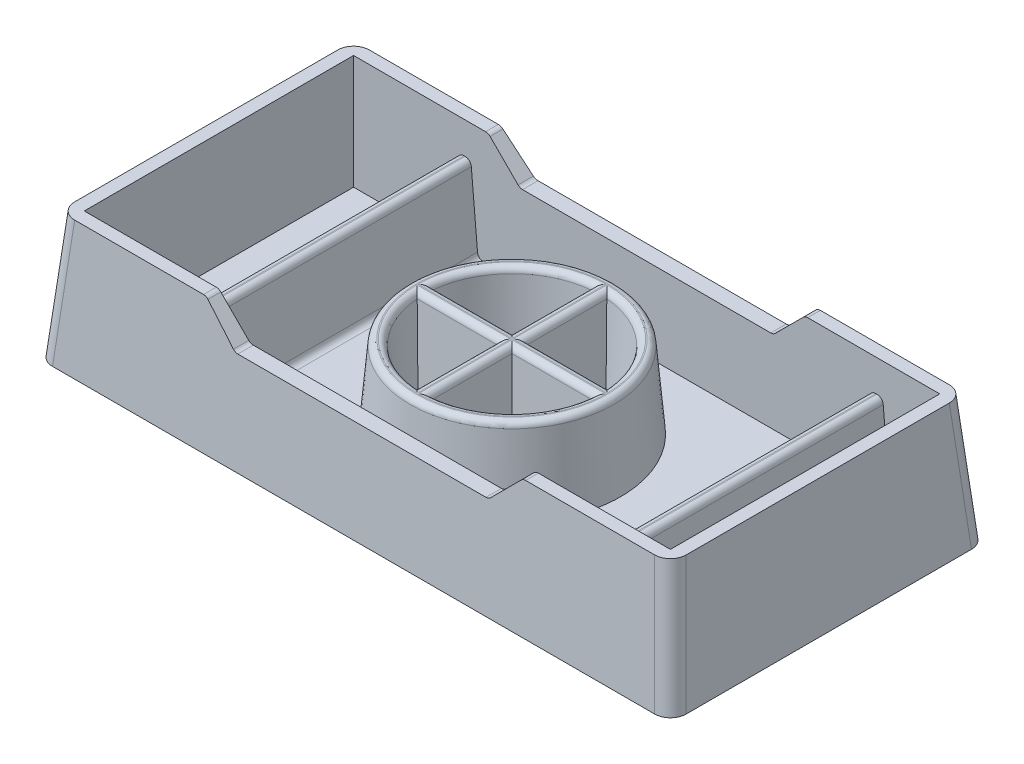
SolidWorks part; units mm, degrees
ref_plane "Ebene vorne" through (0, 0, 0) normal (0, 0, 1) x (1, 0, 0)
ref_plane "Ebene oben" through (0, 0, 0) normal (0, 1, 0) x (1, 0, 0)
ref_plane "Ebene rechts" through (0, 0, 0) normal (1, 0, 0) x (0, 0, -1)
sketch "Skizze1" plane through (0, 0, 0) normal (0, 1, 0) x (1, 0, 0)
  line L1 (-100, 50) -> (100, 50)
  line L2 (-100, 50) -> (-100, -50)
  line L3 (-100, -50) -> (100, -50)
  line L4 (100, 50) -> (100, -50)
  line L5 (-100, 50) -> (100, -50) construction
  line L6 (-100, -50) -> (100, 50) construction
  point P0 (0, 0)
  dimension "D1" = 200
  dimension "D2" = 100
extrude "Aufsatz-Linear austragen1" add sketch "Skizze1" along normal blind 40 draft 5
sketch "Skizze2" plane through (0, 0, 0) normal (0, 0, 1) x (1, 0, 0)
  line L0 (0, 0) -> (0, 84.0076) construction
  line L1 (-50, 40) -> (50, 40)
  line L2 (50, 40) -> (40, 30)
  line L3 (40, 30) -> (-40, 30)
  line L4 (-40, 30) -> (-50, 40)
  line L5 (-96.5005, 40) -> (96.5005, 40) construction
  point P5 (0, 0)
  point P8 (0, 0)
  dimension "D1" = 100
  dimension "D2" = 45
  dimension "D3" = 10
extrude "Schnitt-Linear austragen1" cut sketch "Skizze2" against normal through all both and the other way through all
sketch "Skizze3" plane through (0, 40, 0) normal (0, 1, 0) x (1, 0, 0)
  line L20 (-96.5005, 46.5005) -> (-96.5005, -46.5005) construction
  line L21 (-92.5005, -42.5005) -> (92.5005, -42.5005)
  line L22 (-92.5005, -42.5005) -> (-92.5005, 42.5005)
  line L23 (-92.5005, 42.5005) -> (92.5005, 42.5005)
  line L24 (92.5005, -42.5005) -> (92.5005, 42.5005)
  line L25 (-92.5005, -42.5005) -> (92.5005, 42.5005) construction
  line L26 (-92.5005, 42.5005) -> (92.5005, -42.5005) construction
  line L27 (-96.5005, -46.5005) -> (-50, -46.5005) construction
  point P0 (0, 0)
  dimension "D1" = 4
  dimension "D2" = 4
extrude "Schnitt-Linear austragen2" cut sketch "Skizze3" against normal offset from surface (36 mm away) 4
sketch "Skizze4" plane through (0, 30, 0) normal (0, 1, 0) x (1, 0, 0)
  line L0 (0, 30) -> (0, -30)
  line L1 (-30, 0) -> (30, 0)
  line L2 (-57.5005, 33.2803) -> (-57.5005, -19.7213)
  line L3 (-92.5005, 42.5005) -> (-92.5005, -42.5005) construction
  line L4 (72.5005, 33.2803) -> (72.5005, -27.2003)
  line L5 (92.5005, -42.5005) -> (92.5005, 42.5005) construction
  circle A0 centre (0, 0) radius 30
  dimension "D1" = 60
  dimension "D2" = 35
  dimension "D3" = 20
rib "Verstärkungsrippe3" sketch "Skizze4" sketch "Skizze4" thickness 4 extrusion direction normal to sketch draft on yes draft angle 5 parameters "D1"=4, "D3"=5
fillet "Verrundung1" radius 2 8 edges at (50, 40, 44.5005) (40, 30, 44.9379) (-40, 30, 44.9379) (-50, 40, 44.5005) (50, 40, -44.5005) (40, 30, -44.9379) (-40, 30, -44.9379) (-50, 40, -44.5005)
fillet "Verrundung2" radius 2 13 edges at (19.799, 30, -19.799) (19.799, 30, 19.799) (14.9642, 30, 2) (14.9642, 30, -2) (-2, 30, 14.9642) (2, 30, 14.9642) (0, 30, -32) (-19.799, 30, 19.799) (-14.9642, 30, 2) (-14.9642, 30, -2) (-19.799, 30, -19.799) (2, 30, -14.9642) (-2, 30, -14.9642)
fillet "Verrundung3" radius 2 4 edges at (74.5005, 30, 0) (70.5005, 30, 0) (-59.5005, 30, 0) (-55.5005, 30, 0)
fillet "Verrundung4" radius 2 12 edges at (4.2747, 4, 14.8212) (-4.2747, 4, 14.8212) (-18.1905, 4, 18.1905) (-14.8212, 4, 4.2747) (-14.8212, 4, -4.2747) (-4.2747, 4, -14.8212) (-18.1905, 4, -18.1905) (14.8212, 4, -4.2747) (14.8212, 4, 4.2747) (18.1905, 4, 18.1905) (18.1905, 4, -18.1905) (4.2747, 4, -14.8212)
fillet "Verrundung5" radius 2 4 edges at (68.2257, 4, 0) (76.7752, 4, 0) (-61.7752, 4, 0) (-53.2257, 4, 0)
shell "Schale1" thickness 2
fillet "Verrundung6" radius 5 4 edges at (-98.2502, 20, 48.2502) (98.2502, 20, 48.2502) (98.2502, 20, -48.2502) (-98.2502, 20, -48.2502)
